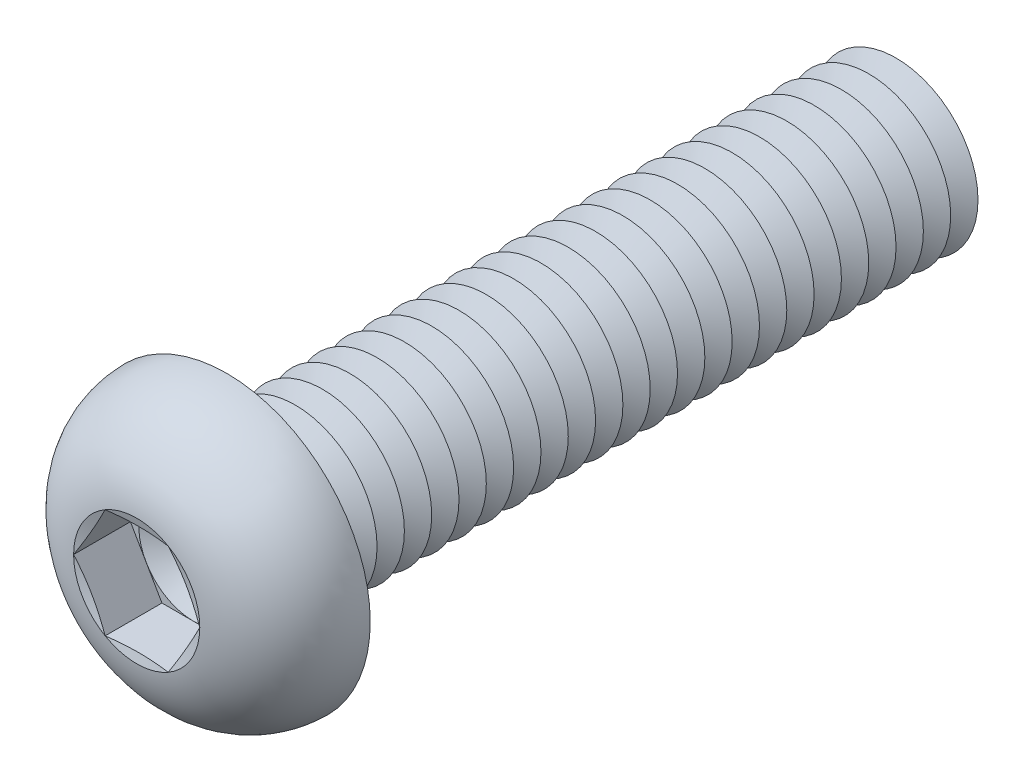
SolidWorks part; units mm, degrees
ref_plane "Front Plane" through (0, 0, 0) normal (0, 0, 1) x (1, 0, 0)
ref_plane "Top Plane" through (0, 0, 0) normal (0, 1, 0) x (1, 0, 0)
ref_plane "Right Plane" through (0, 0, 0) normal (1, 0, 0) x (0, 0, -1)
sketch "Sketch1" plane through (0, 0, 0) normal (1, 0, 0) x (0, 0, -1)
  line L0 (0, 3) -> (0, 5.25)
  line L3 (0, 3) -> (25, 3)
  line L4 (25, 3) -> (25, 0)
  line L5 (25, 0) -> (-3.3, 0) construction
  line L6 (-3.3, 0) -> (25, 0)
  line L7 (-3.3, 2.3094) -> (-3.3, 1.1547) construction
  line L8 (-3.3, 1.1547) -> (-3.3, 0)
  line L9 (-3.3, 2.3094) -> (-2.9906, 1.1547)
  line L10 (-2.9906, 1.1547) -> (-3.3, 1.1547)
  line L11 (25, 0) -> (22.7481, 0) construction
  line L12 (0, 5.25) -> (-3.3, 5.25) construction
  arc A1 (0, 5.25) -> (-3.3, 2.3094) centre (0, 1.928) ccw
  point P8 (25, 1.5)
  dimension "D1" = 10.5
  dimension "D2" = 6
  dimension "D3" = 3.3
  dimension "D4" = 4.6188
  dimension "D5" = 25
  dimension "D6" = 15
revolve "Revolve1" add sketch "Sketch1" angle 360 about L5
fillet "Fillet1" radius 0.5 1 edges at (-3, 0, 0)
sketch "Sketch2" plane through (0, 0, 0) normal (1, 0, 0) x (0, 0, -1)
  line L0 (24.5, 3) -> (25.5, 3)
  line L1 (25, 3) -> (0.5, 3) construction
  line L2 (25.5, 3) -> (25, 2.134)
  line L3 (25, -3) -> (25, 3) construction
  line L4 (25, 2.134) -> (24.5, 3)
  dimension "D1" = 1
revolve "Cut-Revolve1" cut sketch "Sketch2" angle 360 about axis through (0, 0, -25) along (0, 0, -1)
pattern_linear "LPattern1" count 25 spacing 1 along (0, 0, 1) of "Cut-Revolve1"
sketch "Sketch3" plane through (0, 0, 3.3) normal (0, 0, 1) x (1, 0, 0)
  line L7 (1.1547, 2) -> (-1.1547, 2)
  line L8 (-1.1547, 2) -> (-2.3094, 0)
  line L9 (-2.3094, 0) -> (-1.1547, -2)
  line L10 (-1.1547, -2) -> (1.1547, -2)
  line L11 (1.1547, -2) -> (2.3094, 0)
  line L12 (2.3094, 0) -> (1.1547, 2)
  circle A0 centre (0, 0) radius 2 construction
  circle A3 centre (0, 0) radius 2.3094 construction
extrude "Cut-Extrude1" cut sketch "Sketch3" against normal blind 2.08
sketch "Sketch4" plane through (0, 0, 1.22) normal (0, 0, 1) x (1, 0, 0)
  line L1 (1.1547, 2) -> (-1.1547, 2) construction
  circle A0 centre (0, 0) radius 2
extrude "Cut-Extrude2" cut sketch "Sketch4" against normal through all draft 60
